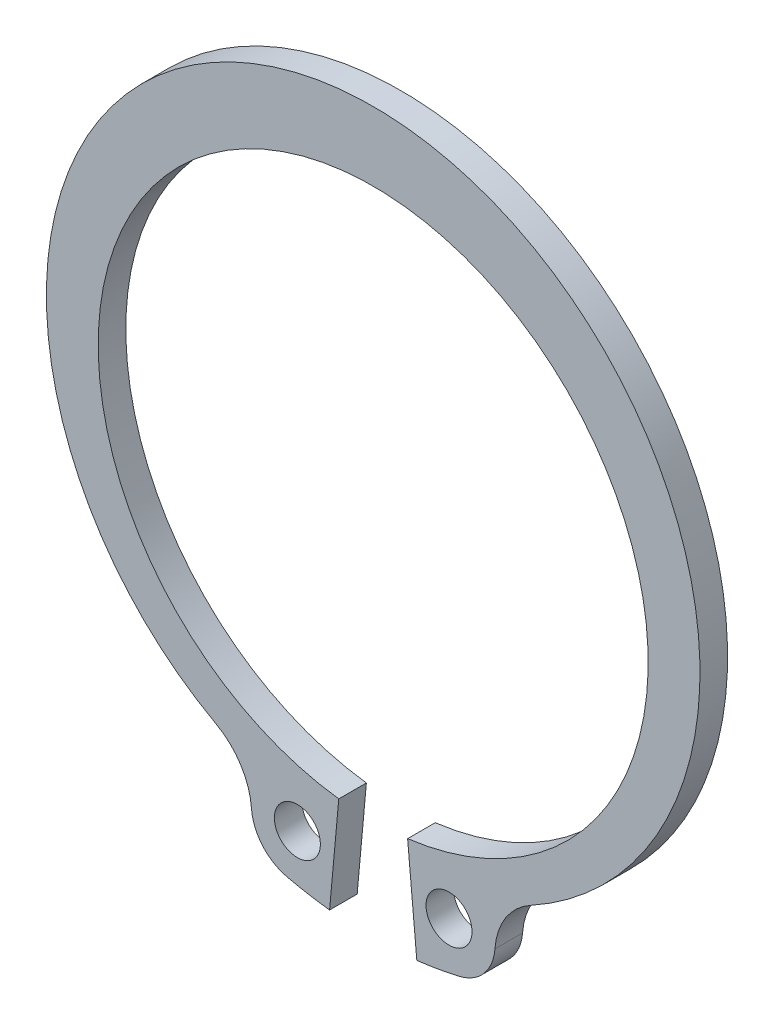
SolidWorks part; units mm, degrees
ref_plane "Face" through (0, 0, 0) normal (0, 0, 1) x (1, 0, 0)
ref_plane "Dessus" through (0, 0, 0) normal (0, 1, 0) x (1, 0, 0)
ref_plane "Droite" through (0, 0, 0) normal (1, 0, 0) x (0, 0, -1)
sketch "Esquisse1" plane through (0, 0, 0) normal (0, 0, 1) x (1, 0, 0)
  line L0 (0, 14.95) -> (0, 11.95) construction
  line L1 (1.4957, -11.856) -> (1.8956, -16.2378)
  line L2 (-1.4957, -11.856) -> (-1.8956, -16.2378)
  line L3 (0.4, -11.5931) -> (0.4, -15.9931) construction
  line L4 (-0.4, -11.5931) -> (-0.4, -15.9931) construction
  arc A0 (1.4957, -11.856) -> (-1.4957, -11.856) centre (0, 0) ccw
  arc A1 (6.8373, -11.6955) -> (-6.8373, -11.6955) centre (0, 0.75) ccw
  arc A2 (1.8956, -16.2378) -> (3.754, -15.9112) centre (0, 0) ccw
  circle A3 centre (3.2948, -13.9647) radius 1
  arc A4 (3.754, -15.9112) -> (5.2896, -14.1088) centre (3.2948, -13.9647) ccw
  arc A5 (6.8373, -11.6955) -> (5.2896, -14.1088) centre (8.2818, -14.3249) ccw
  circle A6 centre (-3.2948, -13.9647) radius 1
  arc A7 (-6.8373, -11.6955) -> (-5.2896, -14.1088) centre (-8.2818, -14.3249) cw
  arc A8 (-3.754, -15.9112) -> (-5.2896, -14.1088) centre (-3.2948, -13.9647) cw
  arc A9 (-1.8956, -16.2378) -> (-3.754, -15.9112) centre (0, 0) cw
  arc A10 (0.4, -11.5931) -> (-0.4, -11.5931) centre (0, 0) ccw construction
  circle A11 centre (0, 0) radius 12.5 construction
  dimension "dgorge" = 23.9
  dimension "D3" = 0.75
  dimension "dtrou" = 2
  dimension "D8" = 2
  dimension "D9" = 3
  dimension "dint" = 23.2
  dimension "dn" = 25
  dimension "b" = 3
  dimension "a" = 4.4
  dimension "D5" = 14.38
  dimension "D7" = 1.6
  dimension "D12" = 0.8
  dimension "D13" = 3.952
  dimension "D14" = 5.214
extrude "Base-Extrusion" add sketch "Esquisse1" along normal blind 1.2
equation "\"D3@Esquisse1\" = \"b@Esquisse1\"/4"
equation "\"D7@Esquisse1\"=\"dtrou@Esquisse1\"*0.8"
equation "\"D8@Esquisse1\" = \"dtrou@Esquisse1\""
equation "\"D9@Esquisse1\" = \"dtrou@Esquisse1\"*1.5"
equation "\"D12@Esquisse1\" = \"dtrou@Esquisse1\"*0.4"
equation "\"D5@Esquisse1\" = 360-(360-\"D13@Esquisse1\")*\"dint@Esquisse1\"/\"dgorge@Esquisse1\""
equation "\"D14@Esquisse1\" = (\"D5@Esquisse1\"-\"D13@Esquisse1\")/2"
